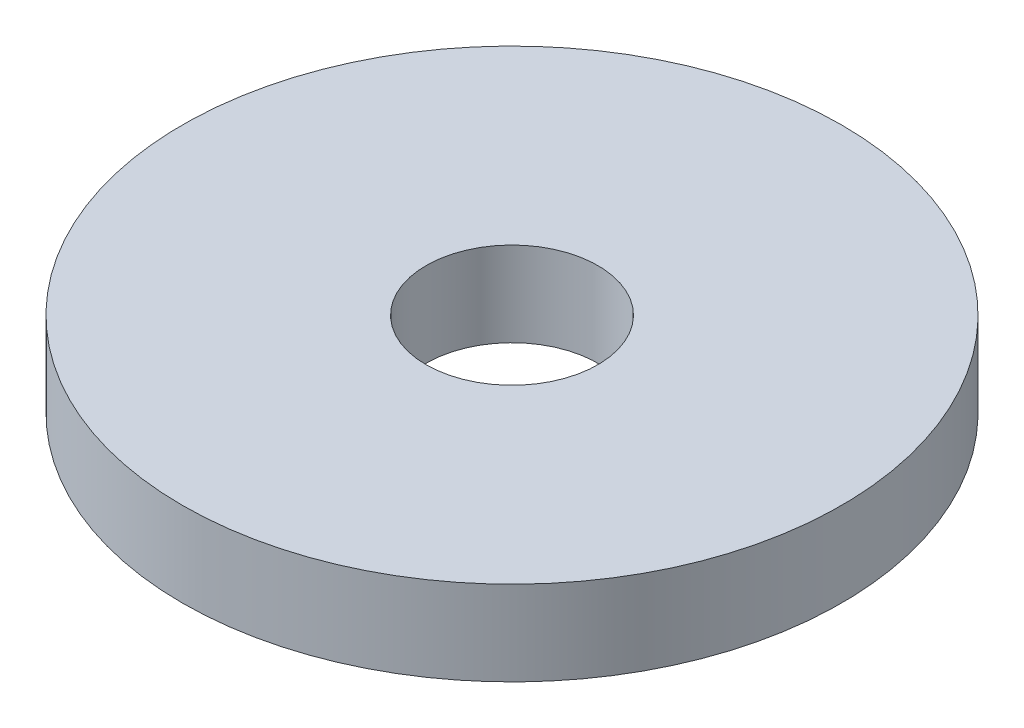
SolidWorks part; units mm, degrees
ref_plane "Front Plane" through (0, 0, 0) normal (0, 0, 1) x (1, 0, 0)
ref_plane "Top Plane" through (0, 0, 0) normal (0, 1, 0) x (1, 0, 0)
ref_plane "Right Plane" through (0, 0, 0) normal (1, 0, 0) x (0, 0, -1)
sketch "Sketch2" plane through (0, 0, 0) normal (0, 1, 0) x (1, 0, 0)
  circle A0 centre (0, 0) radius 3.35
  circle A1 centre (0, 0) radius 12.85
  dimension "D1" = 6.7
  dimension "D2" = 25.7
extrude "Boss-Extrude1" add sketch "Sketch2" along normal blind 3.3
